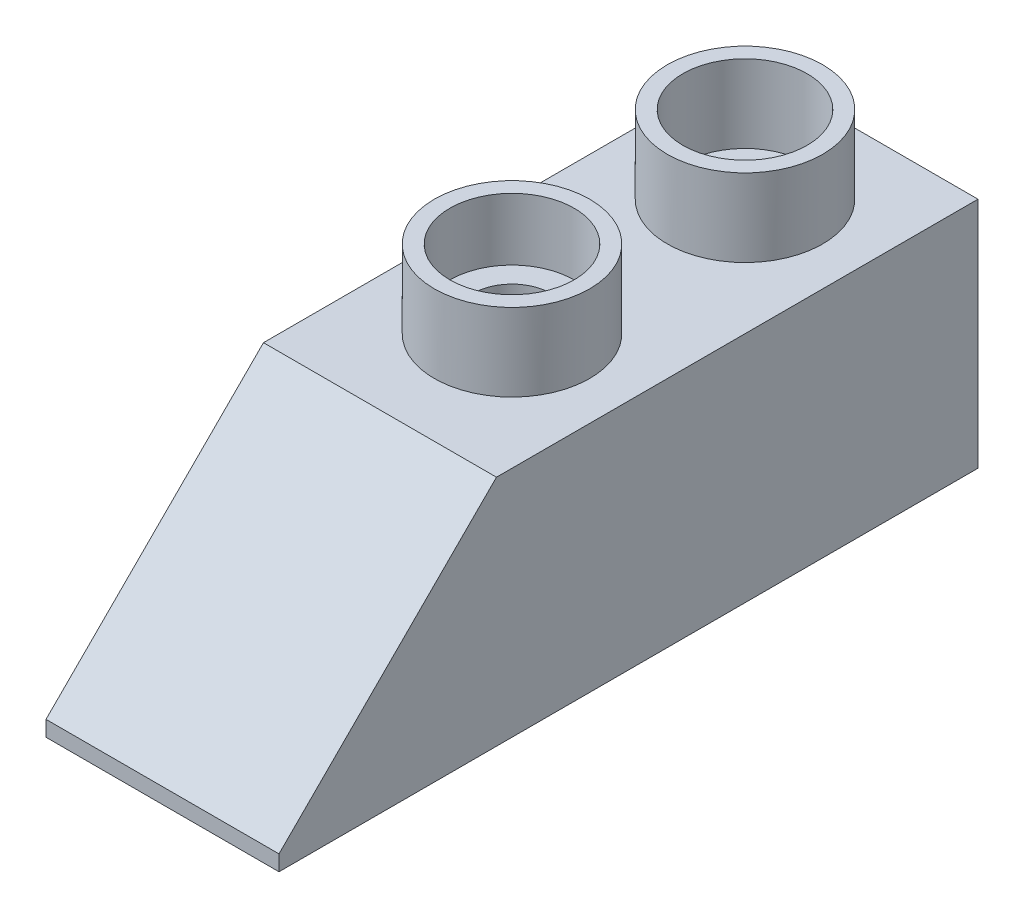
SolidWorks part; units mm, degrees
ref_plane "Front Plane" through (0, 0, 0) normal (0, 0, 1) x (1, 0, 0)
ref_plane "Top Plane" through (0, 0, 0) normal (0, 1, 0) x (1, 0, 0)
ref_plane "Right Plane" through (0, 0, 0) normal (1, 0, 0) x (0, 0, -1)
sketch "Sketch1" plane through (0, 0, 0) normal (0, 1, 0) x (1, 0, 0)
  line L1 (0, 0) -> (-30, 0)
  line L2 (0, 0) -> (0, -90)
  line L3 (0, -90) -> (-30, -90)
  line L4 (-30, 0) -> (-30, -90)
  dimension "D1" = 30
  dimension "D2" = 90
extrude "Boss-Extrude1" add sketch "Sketch1" along normal blind 30
sketch "Sketch2" plane through (0, 30, 0) normal (0, 1, 0) x (1, 0, 0)
  line L0 (0, 0) -> (-30, 0) construction
  line L1 (0, -90) -> (0, 0) construction
  line L2 (-30, 0) -> (-30, -90) construction
  circle A0 centre (-15, -15) radius 10
  circle A1 centre (-15, -45) radius 10
  dimension "D1" = 20
  dimension "D2" = 20
  dimension "D3" = 15
  dimension "D4" = 15
  dimension "D5" = 15
  dimension "D6" = 30
extrude "Boss-Extrude2" add sketch "Sketch2" along normal blind 10
sketch "Sketch3" plane through (0, 40, 0) normal (0, 1, 0) x (1, 0, 0)
  circle A0 centre (-15, -15) radius 8
  dimension "D1" = 16
extrude "Cut-Extrude1" cut sketch "Sketch3" against normal blind 10
sketch "Sketch4" plane through (0, 30, 0) normal (0, 1, 0) x (1, 0, 0)
  circle A0 centre (-15, -15) radius 5
  dimension "D1" = 10
extrude "Cut-Extrude2" cut sketch "Sketch4" against normal through all
hole_wizard "CBORE for M5 Hex Head Bolt1" positions "Sketch6" profile "Sketch5" counterbore size "M5" standard "ANSI Metric"
sketch "Sketch6" plane through (0, 40, 0) normal (0, 1, 0) x (1, 0, 0)
  point P0 (-15, -45)
sketch "Sketch5" plane through (-15, 40, 45) normal (1, 0, 0) x (0, 0, 1)
  line L0 (0, 0) -> (0, 40)
  line L1 (0, 40) -> (5, 40)
  line L3 (5, 40) -> (5, 8)
  line L4 (5, 8) -> (8, 8)
  line L5 (8, 8) -> (8, 0)
  line L7 (8, 0) -> (0, 0)
  line L11 (0, -6.35) -> (0, 107.95) construction
  dimension "Thru Hole Dia." = 10
  dimension "Thru Hole Depth" = 40
  dimension "C'Bore Dia." = 16
  dimension "C'Bore Depth" = 8
chamfer "Chamfer1" distance 28 angle 45 1 edges at (-15, 30, 90)
shell "Shell1" thickness 3
fillet "Fillet1" radius 0.5 19 edges at (-15, 0, 87) (-3, 0.3787, 87) (-3, 0, 45) (-27, 0, 45) (-27, 0.3787, 87) (-15, 0, 37) (-15, 0, 7) (-27, 13.5, 3) (-3, 13.5, 3) (-15, 0, 3) (-15, 27, 37) (-3, 27, 31.8787) (-15, 27, 3) (-27, 27, 31.8787) (-15, 27, 23) (-15, 0.7574, 87) (-3, 13.8787, 73.8787) (-15, 27, 60.7574) (-27, 13.8787, 73.8787)
